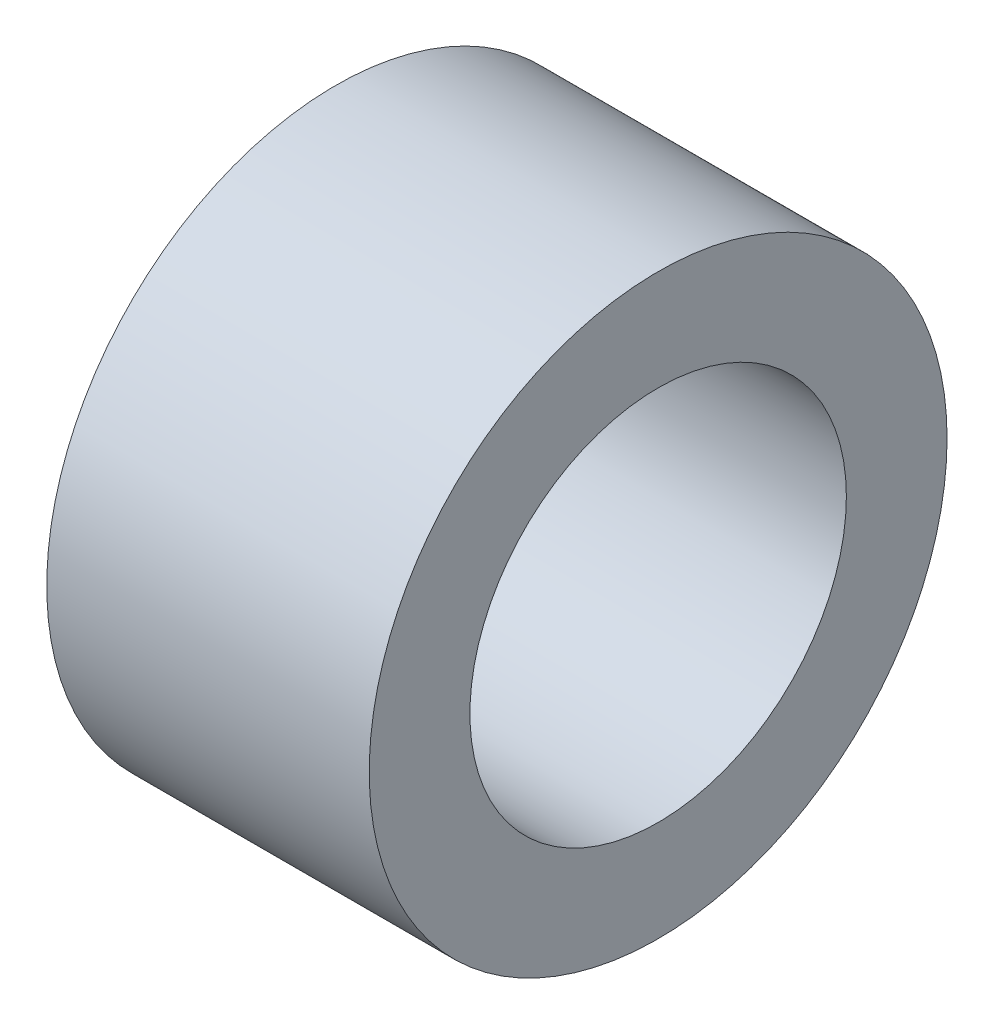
SolidWorks part; units mm, degrees
ref_plane "Front" through (0, 0, 0) normal (0, 0, 1) x (1, 0, 0)
ref_plane "Top" through (0, 0, 0) normal (0, 1, 0) x (1, 0, 0)
ref_plane "Right" through (0, 0, 0) normal (1, 0, 0) x (0, 0, -1)
sketch "Sketch1" plane through (0, 0, 0) normal (0, 0, 1) x (1, 0, 0)
  line L0 (-3.5, 11.2) -> (-16, 11.2)
  line L1 (-3.5, -11) -> (-3.5, 11) construction
  line L2 (-16, 11.2) -> (-16, 7.2966)
  line L3 (-16, 7.2966) -> (-3.5, 7.2966)
  line L4 (-3.5, 7.2966) -> (-3.5, 11.2)
  line L5 (0, 0) -> (-32.8145, 0) construction
  line L6 (-65.5, 0) -> (-3.5, 0) construction
  dimension "D1" = 11.2
  dimension "D2" = 12.5
revolve "Revolve1" add sketch "Sketch1" angle 360 about L5
